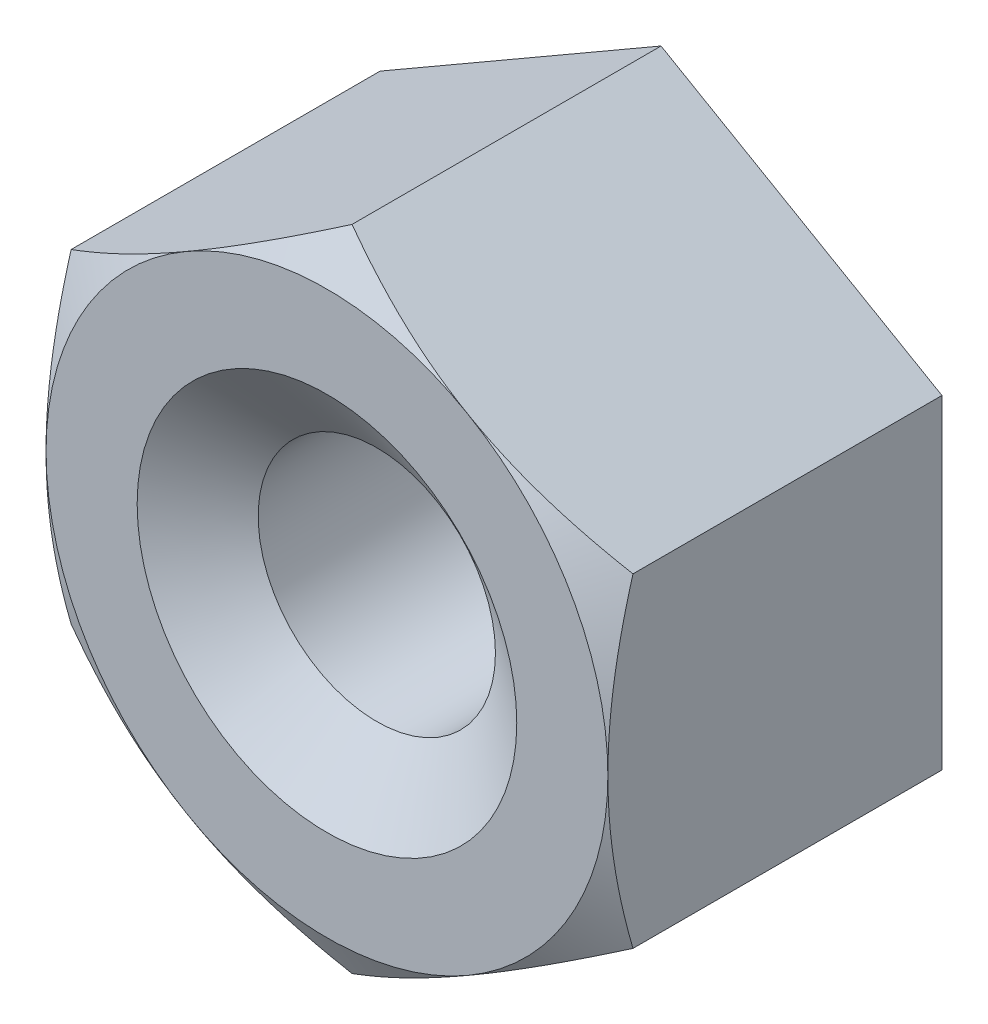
SolidWorks part; units mm, degrees
ref_plane "Plane1" through (0, 0, 0) normal (0, 0, 1) x (1, 0, 0)
ref_plane "Plane2" through (0, 0, 0) normal (0, 1, 0) x (1, 0, 0)
ref_plane "Plane3" through (0, 0, 0) normal (1, 0, 0) x (0, 0, -1)
revolve "EndChamfer" cut sketch "EndChamferSketch" angle 360 about L11
sketch "EndChamferSketch" plane through (0, 0, 0) normal (1, 0, 0) x (0, 0, -1)
  line L0 (11.1506, 6.35) -> (9.3165, 3.7306)
  line L1 (11.2014, 6.35) -> (11.1506, 6.35)
  line L2 (11.2014, 6.35) -> (11.2014, 3.7306)
  line L3 (11.2014, 3.7306) -> (9.3165, 3.7306)
  line L6 (-0.0508, 6.35) -> (0, 6.35)
  line L7 (0, 6.35) -> (1.8341, 3.7306)
  line L9 (1.8341, 3.7306) -> (-0.0508, 3.7306)
  line L10 (-0.0508, 3.7306) -> (-0.0508, 6.35)
  line L11 (25.0375, 0) -> (38.388, 0) construction
  dimension "D1" = 35
  dimension "D2" = 0.0508
  dimension "Offset1" = 11.2014
  dimension "ThreadMajor" = 6.35
  dimension "ChamferDepth" = 2.6194
  dimension "Offset2" = 11.2522
extrude "BaseNut" add sketch "BaseNutSke" against normal blind 11.176
sketch "BaseNutSke" plane through (0, 0, 0) normal (0, 0, 1) x (1, 0, 0)
  line L6 (9.398, 5.4259) -> (9.398, -5.4259)
  line L7 (-9.398, 5.4259) -> (-9.398, -5.4259)
  line L8 (9.398, 5.4259) -> (0, 10.8519)
  line L9 (0, 10.8519) -> (-9.398, 5.4259)
  line L10 (-9.398, -5.4259) -> (0, -10.8519)
  line L11 (0, -10.8519) -> (9.398, -5.4259)
  circle A0 centre (0, 0) radius 3.9688
  dimension "D4" = 9.398
  dimension "Thread_min" = 7.9375
  dimension "D1" = 120
  dimension "D2" = 9.398
  dimension "D3" = 9.398
  dimension "Width_flats" = 18.796
sketch "Sketch4" plane through (0, 0, 0) normal (1, 0, 0) x (0, 0, -1)
  line L4 (0, 0) -> (34.925, 0) construction
  line L7 (0, 9.398) -> (-12.7, 9.398)
  line L8 (0, 5.4259) -> (0, 10.8519) construction
  line L9 (0.8394, 10.8519) -> (0.8394, 23.5519)
  line L10 (0.8394, 23.5519) -> (-12.7, 23.5519)
  line L11 (-12.7, 23.5519) -> (-12.7, 9.398)
  line L12 (0, 9.398) -> (0.8394, 10.8519)
  line L14 (0, 5.4259) -> (0, -5.4259) construction
  line L15 (11.176, 10.8519) -> (0, 10.8519) construction
  dimension "D1" = 9.398
  dimension "D2" = 30
  dimension "D3" = 12.7
  dimension "D4" = 12.7
revolve "Single-Chamfer" cut sketch "Sketch4" angle 360 about L4
sketch "Sketch3" plane through (0, 0, 0) normal (1, 0, 0) x (0, 0, -1)
  line L0 (11.176, 9.398) -> (10.3366, 10.8519)
  line L1 (10.3366, 10.8519) -> (10.3366, 23.5519)
  line L2 (10.3366, 23.5519) -> (23.876, 23.5519)
  line L3 (23.876, 23.5519) -> (23.876, 9.398)
  line L4 (23.876, 9.398) -> (11.176, 9.398)
  line L5 (11.176, 5.4259) -> (11.176, 10.8519) construction
  line L6 (11.176, 10.8519) -> (0.8394, 10.8519) construction
  line L7 (0, 0) -> (38.6776, 0) construction
  line L8 (11.176, 0) -> (0, 0) construction
  line L9 (6.0077, 10.8519) -> (6.0077, 44.222) construction
  line L10 (1.6788, 23.5519) -> (-11.8606, 23.5519)
  line L11 (-11.8606, 23.5519) -> (-11.8606, 9.398)
  line L12 (-11.8606, 9.398) -> (0.8394, 9.398)
  line L13 (0.8394, 9.398) -> (1.6788, 10.8519)
  line L14 (1.6788, 10.8519) -> (1.6788, 23.5519)
  line L16 (11.176, 10.8519) -> (0.8394, 10.8519) construction
  dimension "D1" = 9.398
  dimension "D2" = 30
  dimension "D3" = 12.7
  dimension "D4" = 12.7
revolve "Double-Chamfer" cut sketch "Sketch3" angle 360 about L7
sketch "ThdSchSke" plane through (0, 0, 0) normal (0, 1, 0) x (1, 0, 0)
  line L0 (-6.35, 0.0254) -> (-3.9688, 1.6928)
  line L1 (-3.9688, 1.6928) -> (-1.9844, 1.6928)
  line L2 (-1.9844, 1.6928) -> (-1.9844, -1.642)
  line L3 (-1.9844, -1.642) -> (-3.9688, -1.642)
  line L4 (-3.9688, -1.642) -> (-6.35, 0.0254)
  line L6 (0, 3.9624) -> (0, -2.9874) construction
  line L7 (-4.7625, 1.6129) -> (1.5875, 1.6129) construction
  dimension "D1" = 0.0254
  dimension "VeeAngle" = 70
  dimension "SideAngle" = 55
  dimension "OverCut" = 3.9688
  dimension "Advance" = 1.5875
  dimension "Thread_major" = 12.7
  dimension "Tap_drill" = 7.9375
revolve "ThreadSchematic" cut sketch "ThdSchSke" angle 360 about L6
pattern_linear "ThdSchPat"
equation "\"D2@BaseNutSke\" = \"Width_flats@BaseNutSke\" / 2"
equation "\"D3@BaseNutSke\" = \"Width_flats@BaseNutSke\" / 2"
equation "\"D1@Sketch3\" = \"Width_flats@BaseNutSke\" /2"
equation "\"D4@BaseNutSke\" = \"D3@BaseNutSke\""
equation "\"D1@Sketch4\" = \"Width_flats@BaseNutSke\" / 2"
equation "\"Thread_major@ThdSchSke\" = \"Thread_nominal@ThreadCosmetic\""
equation "\"Tap_drill@ThdSchSke\" = \"Thread_min@BaseNutSke\""
equation "\"Overcut@ThdSchSke\" = \"Tap_drill@ThdSchSke\" * 0.5"
equation "\"Num_threads@ThdSchPat\" = int(  ( \"Thickness@BaseNut\" - 0.002 ) / \"Advance@ThdSchSke\" + 0.999 )  + 1"
equation "\"Advance@ThdSchPat\" = ( \"Thickness@BaseNut\" - 0.002 ) /  (\"Num_threads@ThdSchPat\" - 1) 'relax it"
equation "' \"Num_threads@ThdSchPat\" = \"Num_threads@ThdSchPat\" - sgn( \"Num_threads@ThdSchPat\" - 1) '---chamfered tips only---"
equation "\"ThreadMajor@EndChamferSketch\" = \"Thread_nominal@ThreadCosmetic\" * 0.5"
equation "\"ChamferDepth@EndChamferSketch\" = (\"Thread_nominal@ThreadCosmetic\" - \"Thread_min@BaseNutSke\") * 0.55"
equation "\"Offset1@EndChamferSketch\" = \"Thickness@BaseNut\" + 0.001"
equation "\"Offset2@EndChamferSketch\" = \"Offset1@EndChamferSketch\" + 0.002"
